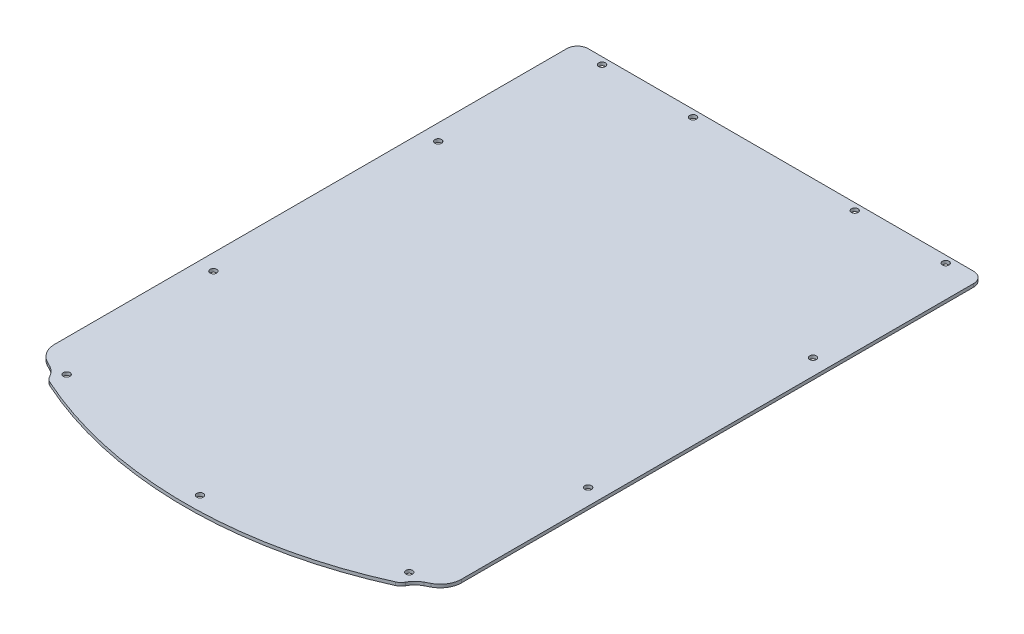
SolidWorks part; units mm, degrees
ref_plane "Front Plane" through (0, 0, 0) normal (0, 0, 1) x (1, 0, 0)
ref_plane "Top Plane" through (0, 0, 0) normal (0, 1, 0) x (1, 0, 0)
ref_plane "Right Plane" through (0, 0, 0) normal (1, 0, 0) x (0, 0, -1)
sketch "Sketch1" plane through (0, 0, 0) normal (0, 1, 0) x (1, 0, 0)
  line L0 (0, -150) -> (0, -125) construction
  line L1 (95, -125) -> (-95, -125) construction
  line L2 (95, -125) -> (95, 125)
  line L3 (95, 125) -> (-95, 125)
  line L4 (-95, -125) -> (-95, 125)
  line L5 (95, -125) -> (-95, 125) construction
  line L6 (95, 125) -> (-95, -125) construction
  arc A0 (-95, -125) -> (95, -125) centre (0, 43) ccw
  point P0 (0, 0)
  dimension "D3" = 25
  dimension "D1" = 190
  dimension "D2" = 250
base flange "Base-Flange1" sketch "Sketch1" thickness 1.5 reverse thickness direction no parameters "D1"=2
sketch "Sketch2" plane through (0, 0, 0) normal (0, 1, 0) x (1, 0, 0)
  line L0 (-82.5, -134.7913) -> (-82.5, -131.4785)
  line L9 (82.5, -134.7913) -> (82.5, -131.4785)
  arc A0 (-95, -125) -> (95, -125) centre (0, 43) ccw construction
  arc A5 (-82.5, -131.4785) -> (82.5, -131.4785) centre (0, 43) ccw
  arc A8 (-96.4767, -127.6114) -> (96.4767, -127.6114) centre (0, 43) ccw
  arc A9 (-82.5, -134.7913) -> (82.5, -134.7913) centre (0, 43) ccw
  point P7 (0, -150)
  dimension "D2" = 165
  dimension "D1" = 3
base flange "Tab1" sketch "Sketch2" thickness 1.5 reverse thickness direction no parameters "D1"=2
fillet "Fillet1" radius 10 4 edges at (-95, -0.75, 125) (95, -0.75, 125) (-82.5, -0.75, 131.4785) (82.5, -0.75, 131.4785)
fillet "Fillet2" radius 5 4 edges at (95, -0.75, -125) (-95, -0.75, -125) (82.5, -0.75, 134.7913) (-82.5, -0.75, 134.7913)
sketch "Sketch3" plane through (0, -1.5, 0) normal (0, -1, 0) x (1, 0, 0)
  circle A0 centre (-79.9805, 128.5187) radius 1.55
  circle A1 centre (0, 146.25) radius 1.55
  circle A2 centre (79.9805, 128.5187) radius 1.55
  circle A3 centre (87.5, 52.5) radius 1.55
  circle A4 centre (87.5, -52.5) radius 1.55
  circle A5 centre (80.25, -121.75) radius 1.55
  circle A6 centre (37.75, -121.75) radius 1.55
  circle A7 centre (-37.75, -121.75) radius 1.55
  circle A8 centre (-80.25, -121.75) radius 1.55
  circle A9 centre (-87.5, -52.5) radius 1.55
  circle A10 centre (-87.5, 52.5) radius 1.55
  dimension "D1" = 3.1
extrude "Cut-Extrude1" cut sketch "Sketch3" against normal through all
sketch "Bend-Lines1" [suppressed] plane through (0, 0, 0) normal (0, 1, 0) x (1, 0, 0)
sketch "Bounding-Box1" [suppressed] plane through (0, 0, 0) normal (0, 1, 0) x (1, 0, 0)
sheet metal parameters "Sheet-Metal1" thickness 1.5 parameters "D1"=2
flat pattern "Flat-Pattern1"
sketch "Bend-Lines2" plane through (0, 0, 0) normal (0, 1, 0) x (1, 0, 0)
sketch3d "Bounding-Box2" [suppressed]
  line L0 (-95, 64.375, 0) -> (-95, -235.625, 0) construction
  line L1 (95, 64.375, 0) -> (95, -235.625, 0) construction
  line L2 (-95, 64.375, 0) -> (95, 64.375, 0) construction
  line L3 (-95, -235.625, 0) -> (95, -235.625, 0) construction
sheet metal parameters "Sheet-Metal2" thickness 1.5 parameters "D1"=2
flat pattern "Flat-Pattern2"
sketch "Bend-Lines3" plane through (0, 0, 0) normal (0, 1, 0) x (1, 0, 0)
sketch3d "Bounding-Box3" [suppressed]
  line L0 (-95, 82, 0) -> (-95, -196, 0) construction
  line L1 (95, 82, 0) -> (95, -196, 0) construction
  line L2 (-95, 82, 0) -> (95, 82, 0) construction
  line L3 (-95, -196, 0) -> (95, -196, 0) construction
sheet metal parameters "Sheet-Metal3" thickness 1.5 parameters "D1"=2
flat pattern "Flat-Pattern2"
sketch "Bend-Lines3" plane through (0, 0, 0) normal (0, 1, 0) x (1, 0, 0)
sketch3d "Bounding-Box3" [suppressed]
  line L0 (-95, 82, 0) -> (-95, -196, 0) construction
  line L1 (95, 82, 0) -> (95, -196, 0) construction
  line L2 (-95, 82, 0) -> (95, 82, 0) construction
  line L3 (-95, -196, 0) -> (95, -196, 0) construction
